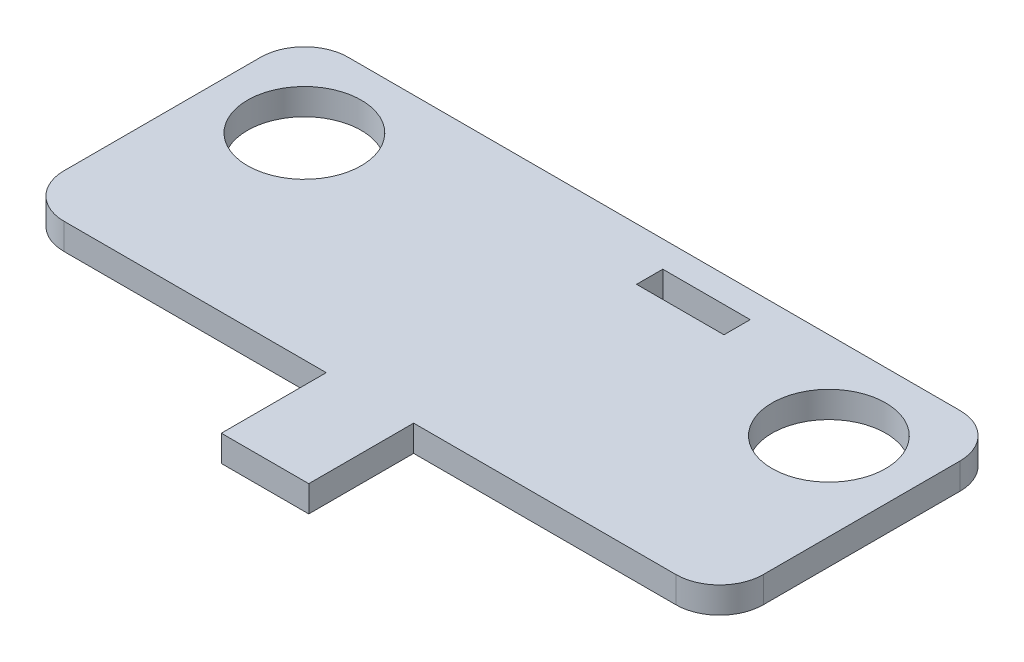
SolidWorks part; units mm, degrees
ref_plane "Front Plane" through (0, 0, 0) normal (0, 0, 1) x (1, 0, 0)
ref_plane "Top Plane" through (0, 0, 0) normal (0, 1, 0) x (1, 0, 0)
ref_plane "Right Plane" through (0, 0, 0) normal (1, 0, 0) x (0, 0, -1)
sketch "Sketch1" plane through (0, 0, 0) normal (0, 1, 0) x (1, 0, 0)
  line L1 (-40, 16.25) -> (40, 16.25)
  line L2 (-40, 16.25) -> (-40, -16.25)
  line L3 (-40, -16.25) -> (40, -16.25)
  line L4 (40, 16.25) -> (40, -16.25)
  line L5 (-40, 16.25) -> (40, -16.25) construction
  line L6 (-40, -16.25) -> (40, 16.25) construction
  point P0 (0, 0)
  dimension "D1" = 80
  dimension "D2" = 32.5
extrude "Boss-Extrude1" add sketch "Sketch1" along normal blind 3
fillet "Fillet1" radius 5 4 edges at (-40, 1.5, -16.25) (40, 1.5, -16.25) (40, 1.5, 16.25) (-40, 1.5, 16.25)
sketch "Sketch2" plane through (0, 3, 0) normal (0, 1, 0) x (1, 0, 0)
  line L1 (-30, 6.25) -> (30, 6.25) construction
  line L2 (35, 16.25) -> (-35, 16.25) construction
  line L3 (0, -1.65) -> (0, 1.65) construction
  circle A0 centre (-30, 6.25) radius 6.5049
  circle A1 centre (30, 6.25) radius 6.5049
  dimension "D1" = 10
  dimension "D2" = 30
  dimension "D3" = 30
extrude "Cut-Extrude1" cut sketch "Sketch2" against normal blind 3
sketch "Sketch3" plane through (0, 3, 0) normal (0, 1, 0) x (1, 0, 0)
  line L1 (-5, -16.25) -> (5, -16.25)
  line L2 (-5, -16.25) -> (-5, -28.25)
  line L3 (-5, -28.25) -> (5, -28.25)
  line L4 (5, -16.25) -> (5, -28.25)
  line L5 (-5, -16.25) -> (5, -28.25) construction
  line L6 (-5, -28.25) -> (5, -16.25) construction
  line L7 (-35, -16.25) -> (35, -16.25) construction
  point P0 (0, -22.25)
  dimension "D1" = 6
  dimension "D2" = 10
  dimension "D3" = 12
extrude "Boss-Extrude2" add sketch "Sketch3" against normal blind 3
sketch "Sketch4" plane through (0, 3, 0) normal (0, 1, 0) x (1, 0, 0)
  line L0 (35, 16.25) -> (-35, 16.25) construction
  line L1 (4, 13.25) -> (14, 13.25)
  line L2 (4, 13.25) -> (4, 10.25)
  line L3 (4, 10.25) -> (14, 10.25)
  line L4 (14, 13.25) -> (14, 10.25)
  line L5 (4, 13.25) -> (14, 10.25) construction
  line L6 (4, 10.25) -> (14, 13.25) construction
  line L7 (40, -11.25) -> (40, 11.25) construction
  point P0 (9, 11.75)
  dimension "D1" = 4.5
  dimension "D2" = 31
  dimension "D3" = 3
  dimension "D4" = 10
extrude "Cut-Extrude2" cut sketch "Sketch4" against normal blind 3
